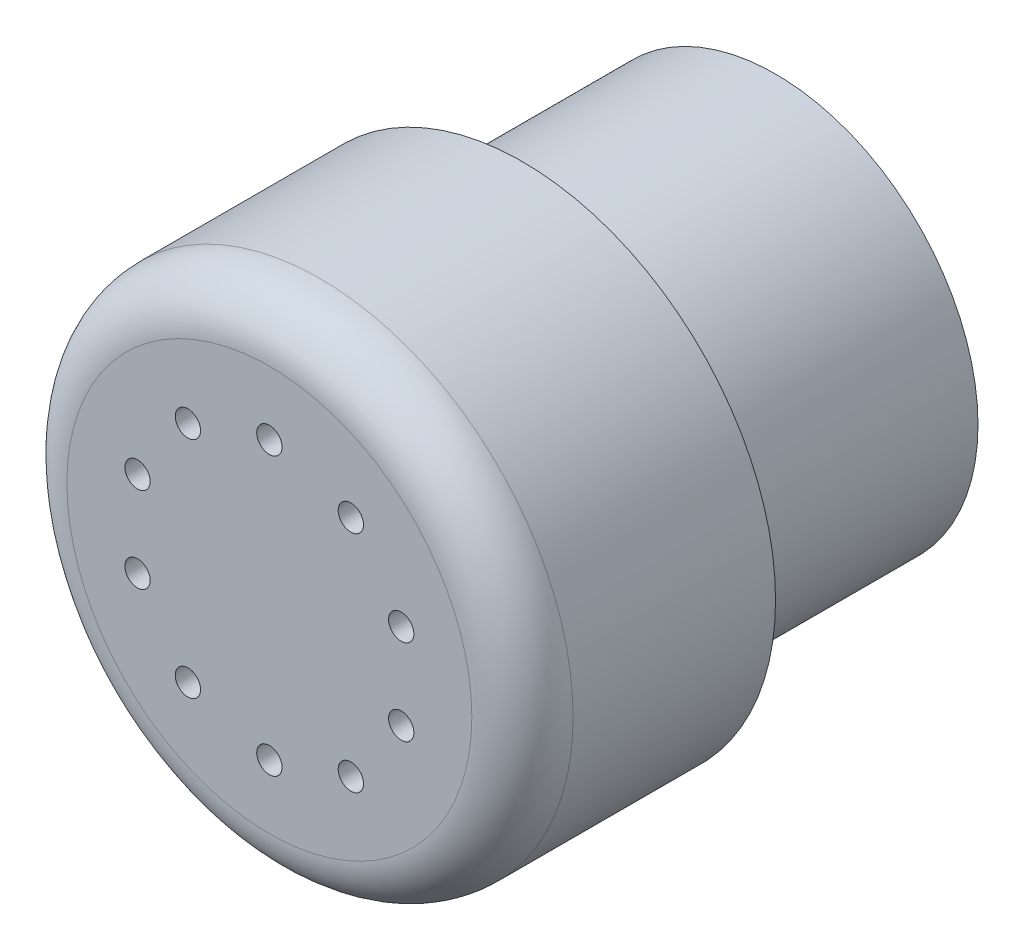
SolidWorks part; units mm, degrees
ref_plane "前基準面" through (0, 0, 0) normal (0, 0, 1) x (1, 0, 0)
ref_plane "上基準面" through (0, 0, 0) normal (0, 1, 0) x (1, 0, 0)
ref_plane "右基準面" through (0, 0, 0) normal (1, 0, 0) x (0, 0, -1)
sketch "草圖1" plane through (0, 0, 0) normal (0, 0, 1) x (1, 0, 0)
  circle A0 centre (0, 0) radius 10
  dimension "D1" = 20
extrude "填料-伸長1" add sketch "草圖1" along normal blind 10
sketch "草圖2" plane through (0, 0, 0) normal (0, 0, -1) x (-1, 0, 0)
  circle A0 centre (0, 0) radius 8
  dimension "D1" = 16
extrude "填料-伸長2" add sketch "草圖2" along normal blind 10
fillet "圓角1" radius 2 1 edges at (10, 0, 10)
sketch "草圖3" plane through (0, 0, 10) normal (0, 0, 1) x (1, 0, 0)
  circle A0 centre (0, 5.4778) radius 0.5
  circle A1 centre (3.2198, 4.4317) radius 0.5
  circle A2 centre (5.2097, 1.6927) radius 0.5
  circle A3 centre (5.2097, -1.6927) radius 0.5
  circle A4 centre (3.2198, -4.4317) radius 0.5
  circle A5 centre (0, -5.4778) radius 0.5
  circle A6 centre (-3.2198, -4.4317) radius 0.5
  circle A7 centre (-5.2097, -1.6927) radius 0.5
  circle A8 centre (-5.2097, 1.6927) radius 0.5
  circle A9 centre (-3.2198, 4.4317) radius 0.5
  dimension "D1" = 1
  dimension "D2" = 10
extrude "除料-伸長1" cut sketch "草圖3" against normal blind 1
